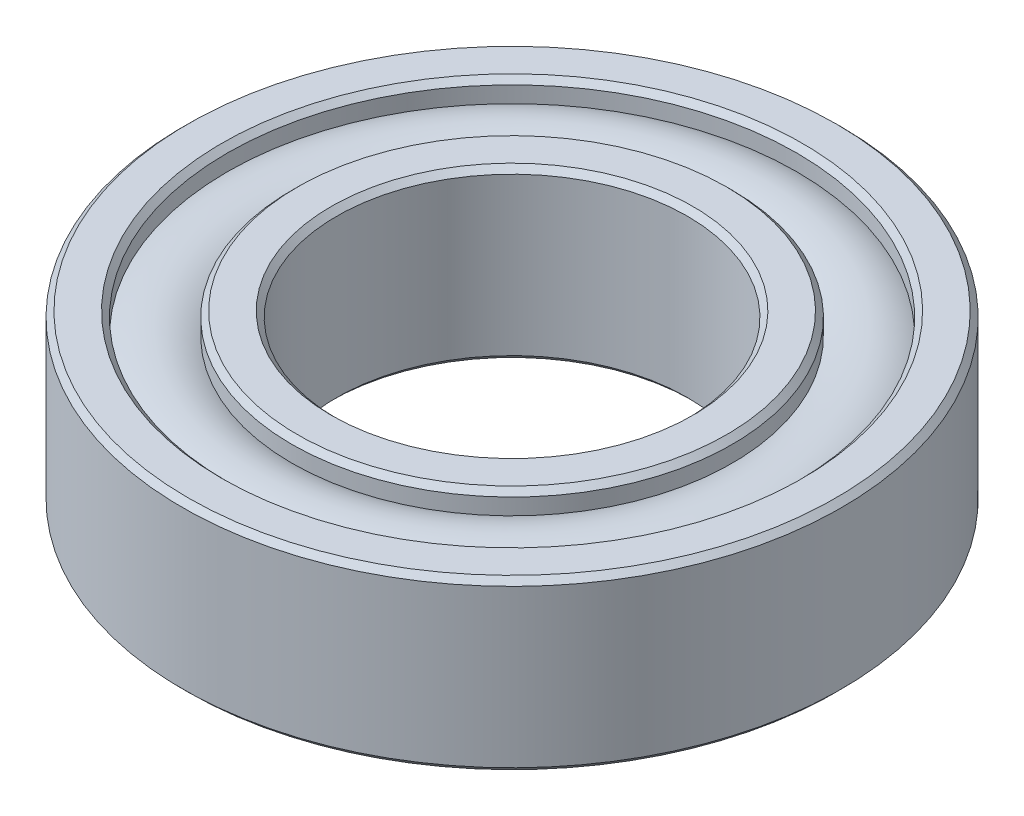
SolidWorks part; units mm, degrees
ref_plane "Face" through (0, 0, 0) normal (0, 0, 1) x (1, 0, 0)
ref_plane "Dessus" through (0, 0, 0) normal (0, 1, 0) x (1, 0, 0)
ref_plane "Droite" through (0, 0, 0) normal (1, 0, 0) x (0, 0, -1)
sketch "Esquisse1" plane through (0, 0, 0) normal (0, 0, 1) x (1, 0, 0)
  line L0 (0, 0) -> (0, 45.5765) construction
  line L1 (23.5, 12) -> (12.5, 0) construction
  line L2 (12.5, 0) -> (15.7, 0)
  line L3 (12.5, 0) -> (12.5, 12)
  line L4 (12.5, 12) -> (15.7, 12)
  line L5 (15.7, 0) -> (15.7, 1.5604)
  line L6 (20.3, 0) -> (23.5, 0)
  line L7 (20.3, 0) -> (20.3, 1.5604)
  line L8 (20.3, 12) -> (23.5, 12)
  line L9 (23.5, 0) -> (23.5, 12)
  line L10 (20.3, 10.4396) -> (20.3, 12)
  line L11 (15.7, 10.4396) -> (15.7, 12)
  arc A0 (20.3, 10.4396) -> (15.7, 10.4396) centre (18, 6) ccw
  arc A1 (15.7, 1.5604) -> (20.3, 1.5604) centre (18, 6) ccw
  dimension "D1" = 10
  dimension "D2" = 31.4
  dimension "D3" = 25
  dimension "D4" = 47
  dimension "D5" = 12
revolve "Révolution1" add sketch "Esquisse1" angle 360 about L0
chamfer "Chanfrein1" distance 0.4 angle 45 8 edges at (0, 0, -12.5) (0, 0, -15.7) (0, 0, -20.3) (0, 0, -23.5) (0, 12, -23.5) (0, 12, -20.3) (0, 12, -15.7) (0, 12, -12.5)
